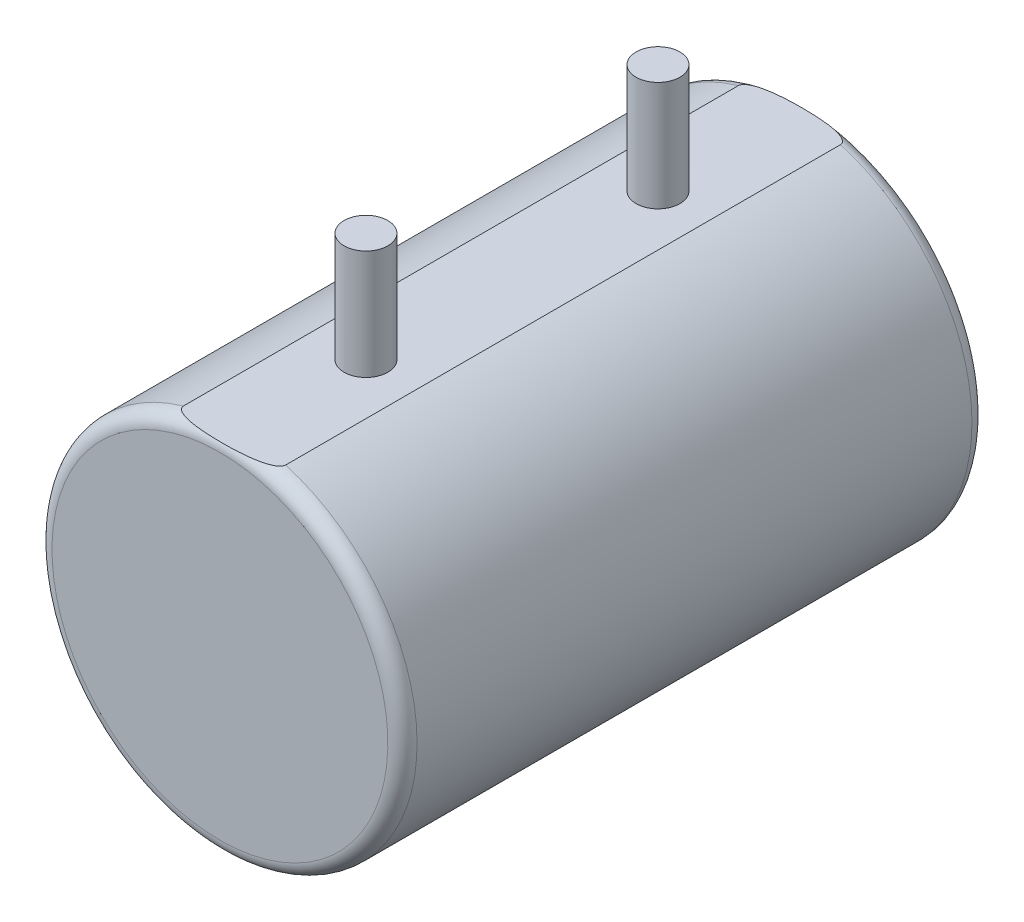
SolidWorks part; units mm, degrees
ref_plane "Plan de face" through (0, 0, 0) normal (0, 0, 1) x (1, 0, 0)
ref_plane "Plan de dessus" through (0, 0, 0) normal (0, 1, 0) x (1, 0, 0)
ref_plane "Plan de droite" through (0, 0, 0) normal (1, 0, 0) x (0, 0, -1)
sketch "Esquisse1" plane through (0, 0, 0) normal (0, 0, 1) x (1, 0, 0)
  circle A0 centre (0, 0) radius 25
  dimension "D1" = 50
extrude "Boss.-Extru.1" add sketch "Esquisse1" along normal mid plane 80
sketch "Esquisse2" plane through (0, 0, 40) normal (0, 0, 1) x (1, 0, 0)
  line L1 (-12.7271, 34.0157) -> (13.8136, 34.0157)
  line L2 (-12.7271, 34.0157) -> (-12.7271, 24)
  line L3 (-12.7271, 24) -> (13.8136, 24)
  line L4 (13.8136, 34.0157) -> (13.8136, 24)
  dimension "D1" = 24
extrude "Enlèv. mat.-Extru.1" cut sketch "Esquisse2" against normal through all
sketch "Esquisse3" plane through (0, 24, 0) normal (0, 1, 0) x (1, 0, 0)
  circle A0 centre (0, 20) radius 3
  circle A1 centre (0, -20) radius 3
  dimension "D3" = 6
  dimension "D4" = 6
  dimension "D1" = 40
  dimension "D2" = 20
extrude "Boss.-Extru.2" add sketch "Esquisse3" along normal blind 15
fillet "Congé1" radius 2 2 edges at (0, -25, 40) (0, -25, -40)
